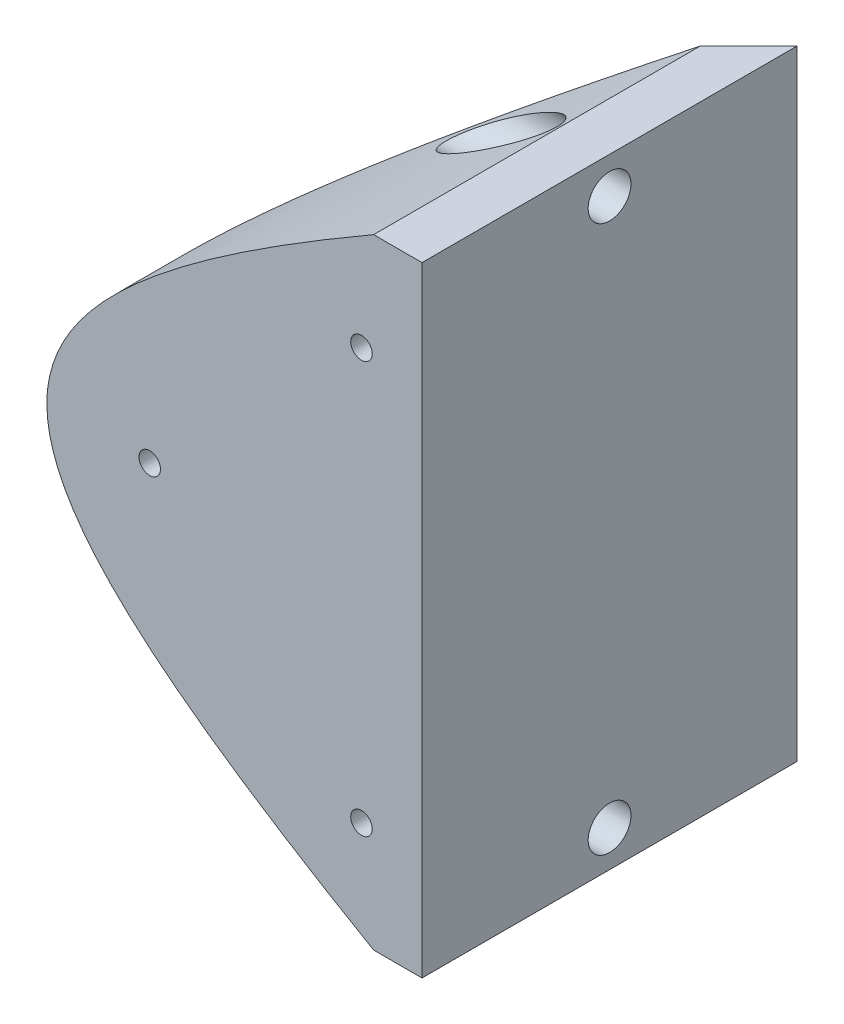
SolidWorks part; units mm, degrees
ref_plane "Front Plane" through (0, 0, 0) normal (0, 0, 1) x (1, 0, 0)
ref_plane "Top Plane" through (0, 0, 0) normal (0, 1, 0) x (1, 0, 0)
ref_plane "Right Plane" through (0, 0, 0) normal (1, 0, 0) x (0, 0, -1)
sketch "Sketch1" plane through (0, 0, 0) normal (0, 1, 0) x (1, 0, 0)
  line L0 (0, 0) -> (0, 39.37)
  line L1 (0, 39.37) -> (-39.37, 0)
  line L2 (-39.37, 0) -> (0, 0)
  dimension "D1" = 39.37
  dimension "D2" = 45
extrude "Boss-Extrude1" add sketch "Sketch1" along normal mid plane 65.024
sketch "Sketch2" plane through (0, 0, 0) normal (0, 0, 1) x (1, 0, 0)
  line L2 (-39.37, -32.512) -> (-39.37, 32.512) construction
  line L6 (-5.08, 32.512) -> (52.5493, 65.7843) construction
  line L7 (-39.37, 32.512) -> (0, 32.512) construction
  line L8 (-5.08, 32.512) -> (-5.08, -32.512) construction
  line L9 (-39.37, -32.512) -> (0, -32.512) construction
  line L10 (-5.08, -32.512) -> (0, -32.512)
  line L11 (0, -32.512) -> (0, 32.512)
  line L12 (0, 32.512) -> (-5.08, 32.512)
  conic Q0
  dimension "D1" = 5.08
  dimension "D2" = 30
extrude "Cut-Extrude1" cut sketch "Sketch2" against normal through all flip side to cut
sketch "Sketch3" plane through (0, 0, 0) normal (0, 0, 1) x (1, 0, 0)
  line L0 (0, 0) -> (-6.35, 0) construction
  line L1 (-6.35, 21.59) -> (-6.35, -21.59) construction
  circle A0 centre (-6.35, 21.59) radius 1.1303
  circle A1 centre (-6.35, -21.59) radius 1.1303
  circle A2 centre (-28.575, 0) radius 1.1303
  dimension "D1" = 2.2606
  dimension "D2" = 43.18
  dimension "D3" = 6.35
  dimension "D4" = 22.225
extrude "Cut-Extrude2" cut sketch "Sketch3" against normal offset from surface (32.3542 mm away) 1.27
ref_plane "Plane1" through (0, 0, -19.685) normal (0, 0, 1) x (1, 0, 0)
sketch "Sketch4" plane through (0, 0, -19.685) normal (0, 0, 1) x (1, 0, 0)
  line L0 (-45.0628, 28.702) -> (26.7469, 28.702) construction
  line L1 (0, 28.702) -> (0, -28.702) construction
  line L2 (-22.0314, 32.258) -> (-3.175, 32.258)
  line L3 (-3.175, 32.258) -> (-3.175, 30.9499)
  line L4 (-3.175, 30.9499) -> (0, 30.9499)
  line L5 (0, -32.512) -> (0, 32.512) construction
  line L6 (0, 30.9499) -> (0, 28.702)
  line L7 (0, 28.702) -> (-22.0314, 28.702)
  line L8 (-22.0314, 28.702) -> (-22.0314, 32.258)
  spline S0 degree 2 poles (-5.08, 32.512) (-39.37, 12.7147) (-39.37, 0) knots 0 0 0 0.5 0.5 0.5 weights 1 1.278524 1.278524 construction
  point P4 (-5.5192, 32.258)
  dimension "D1" = 57.404
  dimension "D2" = 4.4958
  dimension "D3" = 7.112
  dimension "D4" = 3.175
revolve "Cut-Revolve1" cut sketch "Sketch4" angle 360 about L0
mirror "Mirror1" about plane through (0, 0, 0) normal (0, 1, 0) of "Cut-Revolve1"
